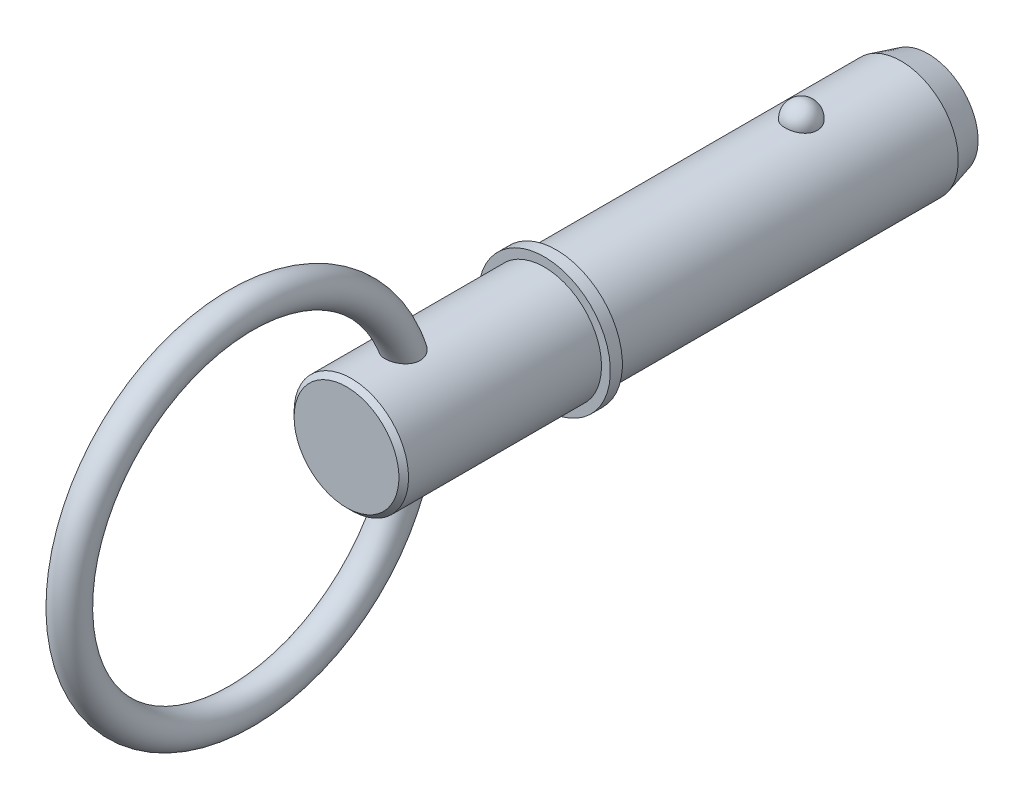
SolidWorks part; units mm, degrees
ref_plane "Front Plane" through (0, 0, 0) normal (0, 0, 1) x (1, 0, 0)
ref_plane "Top Plane" through (0, 0, 0) normal (0, 1, 0) x (1, 0, 0)
ref_plane "Right Plane" through (0, 0, 0) normal (1, 0, 0) x (0, 0, -1)
sketch "Sketch2" plane through (0, 0, 0) normal (0, 0, 1) x (1, 0, 0)
  circle A0 centre (0, 0) radius 9.525
  point P3 (0, 9.525)
  dimension "D1" = 19.05
extrude "Boss-Extrude1" add sketch "Sketch2" along normal blind 38.1
sketch "Sketch3" plane through (0, 0, 0) normal (0, 0, -1) x (-1, 0, 0)
  circle A0 centre (0, 0) radius 9.525
  dimension "D1" = 19.05
extrude "Boss-Extrude2" add sketch "Sketch3" along normal blind 23.8
chamfer "Chamfer1" distance 4.5 angle 15 1 edges at (-9.525, 0, -23.8)
sketch "Sketch18" plane through (0, 0, 0) normal (1, 0, 0) x (0, 0, -1)
  line L0 (19.3, 9.525) -> (-38.1, 9.525) construction
  line L1 (2.69, 12.215) -> (2.69, 6.835)
  line L2 (-38.1, -9.525) -> (19.3, -9.525) construction
  arc A0 (2.69, 12.215) -> (2.69, 6.835) centre (2.69, 9.525) ccw
  point P4 (0, 9.525)
  dimension "D1" = 21.74
revolve "Revolve1" add sketch "Sketch18" angle 360 about L1
sketch "Sketch19" plane through (0, 0, 0) normal (1, 0, 0) x (0, 0, -1)
  line L0 (-33.7288, 0) -> (-46.4542, 0) construction
sketch "Sketch20" plane through (0, 0, 0) normal (1, 0, 0) x (0, 0, -1)
  line L0 (-38.1, 0) -> (-38.1, 11)
  line L1 (-38.1, 9.525) -> (-38.1, -9.525) construction
  line L2 (-38.1, 11) -> (-40.1, 11)
  line L3 (-40.1, 11) -> (-40.1, 0)
  line L4 (-33.7288, 0) -> (-46.4542, 0) construction
  line L5 (-40.1, 0) -> (-38.1, 0)
  dimension "D1" = 11
  dimension "D2" = 2
revolve "Revolve2" add sketch "Sketch20" angle 360 about L0
sketch "Sketch21" plane through (0, 0, 38.1) normal (0, 0, -1) x (-1, 0, 0)
  circle A0 centre (0, 0) radius 9.525
  dimension "D1" = 19.05
extrude "Boss-Extrude3" add sketch "Sketch21" against normal blind 34.93
chamfer "Chamfer2" distance 0.8 angle 45 1 edges at (-9.525, 0, 73.03)
sketch "Sketch23" plane through (0, 0, 0) normal (1, 0, 0) x (0, 0, -1)
  line L0 (-73.03, 8.725) -> (-73.03, -8.725) construction
  circle A0 centre (-90.605, 0) radius 28.575
  point P2 (-62.03, 0)
  dimension "D1" = 57.15
  dimension "D2" = 11
sketch "Sketch24" plane through (0, 0, 0) normal (0, 1, 0) x (1, 0, 0)
  circle A0 centre (0, -62.03) radius 2.75
  dimension "D1" = 5.5
sweep "Sweep1" add profiles "Sketch24" path "Sketch23"
